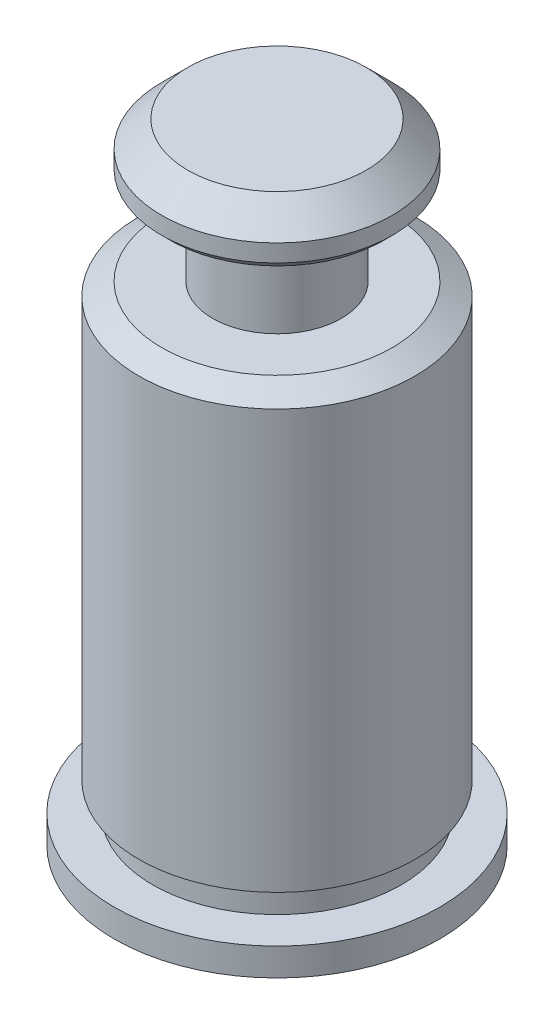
SolidWorks part; units mm, degrees
ref_plane "Plane1" through (0, 0, 0) normal (0, 0, 1) x (1, 0, 0)
ref_plane "Plane2" through (0, 0, 0) normal (0, 1, 0) x (1, 0, 0)
ref_plane "Plane3" through (0, 0, 0) normal (1, 0, 0) x (0, 0, -1)
sketch "BodySke" plane through (0, 0, 0) normal (0, 0, 1) x (1, 0, 0)
  line L0 (2.6924, 0) -> (3.175, 0)
  line L1 (3.175, 0) -> (3.175, 0.5385)
  line L2 (3.175, 0.5385) -> (2.4232, 0.5385)
  line L3 (1.2573, 9.525) -> (1.2573, 11.2522)
  line L4 (2.6924, 1.1039) -> (2.4232, 1.1039)
  line L5 (2.4232, 1.1039) -> (2.4232, 0.5385)
  line L6 (2.6924, 0.0051) -> (2.6924, 0)
  line L7 (0, 0.0051) -> (2.6924, 0.0051)
  line L8 (2.2479, 9.525) -> (1.2573, 9.525)
  line L9 (0, 0) -> (0, 15.24) construction
  line L10 (1.2573, 11.2522) -> (2.0786, 11.2522)
  line L11 (2.6924, 9.2684) -> (2.6924, 1.1039)
  line L12 (2.0786, 11.2522) -> (2.2479, 11.4215)
  line L13 (0, 0.0051) -> (0, 12.2682)
  line L14 (2.2479, 11.4215) -> (2.2479, 11.7602)
  line L15 (2.2479, 11.7602) -> (1.7399, 12.2682)
  line L16 (1.7399, 12.2682) -> (0, 12.2682)
  line L17 (2.2479, 9.525) -> (2.6924, 9.2684)
  dimension "D1" = 0.0051
  dimension "H_dia" = 6.35
  dimension "D2" = 45
  dimension "C_dia" = 5.3848
  dimension "D3" = 45
  dimension "D4" = 30
  dimension "Clinching_ht" = 0.5385
  dimension "Length" = 9.525
  dimension "Groove_wid" = 0.5654
  dimension "Groove_dia" = 4.8463
  dimension "B_dia" = 4.4958
  dimension "A_dia" = 2.5146
  dimension "S_dim" = 1.7272
  dimension "M_dim" = 2.7432
  dimension "Top_chamfer_ht" = 0.508
  dimension "Under_chamfer_ht" = 0.1693
revolve "Body" add sketch "BodySke" angle 360 about L9
ref_plane "Plane4" through (0, -0.5486, 0) normal (0, 1, 0) x (-1, 0, 0)
equation "' \"Length@BodySke\" = 0.375"
equation "' \"A_dia@BodySke\" = 0.099"
equation "' \"B_dia@BodySke\" = 0.177"
equation "' \"C_dia@BodySke\" = 0.212"
equation "' \"S_dim@BodySke\" = 0.068"
equation "' \"M_dim@BodySke\" = 0.108"
equation "' \"H_dia@BodySke\" = 0.25"
equation "\"Top_chamfer_ht@BodySke\" = ( \"M_dim@BodySke\" - \"S_dim@BodySke\" ) * 0.5"
equation "\"Under_chamfer_ht@BodySke\" = \"Top_chamfer_ht@BodySke\" / 3"
equation "\"Clinching_ht@BodySke\" = \"C_dia@BodySke\" * 0.1"
equation "\"Groove_dia@BodySke\" = \"C_dia@BodySke\" * 0.9"
equation "\"Groove_wid@BodySke\" = \"Clinching_ht@BodySke\" * 1.05"
